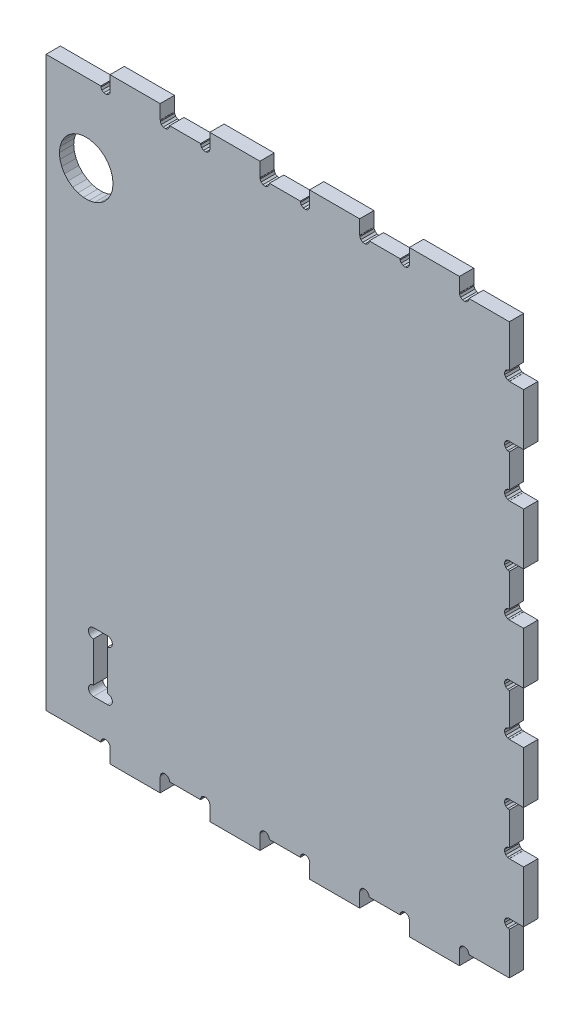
SolidWorks part; units mm, degrees
ref_plane "Спереди" through (0, 0, 0) normal (0, 0, 1) x (1, 0, 0)
ref_plane "Сверху" through (0, 0, 0) normal (0, 1, 0) x (1, 0, 0)
ref_plane "Справа" through (0, 0, 0) normal (1, 0, 0) x (0, 0, -1)
sketch "Sketch1" plane through (0, 0, 0) normal (0, 0, 1) x (1, 0, 0)
  line L0 (-104.444, -500.0143) -> (-104.328, -500.0143)
  line L1 (-104.328, -500.0143) -> (-104.328, -499.0573)
  line L2 (-104.328, -499.0573) -> (-103.438, -497.3623)
  line L3 (-103.438, -497.3623) -> (-101.863, -496.2743)
  line L4 (-101.863, -496.2743) -> (-99.9623, -496.0433)
  line L5 (-99.9623, -496.0433) -> (-98.1722, -496.7223)
  line L6 (-98.1722, -496.7223) -> (-96.9026, -498.1553)
  line L7 (-96.9026, -498.1553) -> (-96.4444, -500.0143)
  line L8 (-96.4444, -500.0143) -> (-70.5504, -500.0143)
  line L9 (-70.5504, -500.0143) -> (-70.5504, -499.0573)
  line L10 (-70.5504, -499.0573) -> (-69.6607, -497.3623)
  line L11 (-69.6607, -497.3623) -> (-68.0851, -496.2743)
  line L12 (-68.0851, -496.2743) -> (-66.1845, -496.0433)
  line L13 (-66.1845, -496.0433) -> (-64.3944, -496.7223)
  line L14 (-64.3944, -496.7223) -> (-63.1248, -498.1553)
  line L15 (-63.1248, -498.1553) -> (-62.6667, -500.0143)
  line L16 (-62.6667, -500.0143) -> (-62.8667, -500.8253)
  line L17 (-62.8667, -500.8253) -> (-62.8667, -512.0143)
  line L18 (-62.8667, -512.0143) -> (-20.8889, -512.0143)
  line L19 (-20.8889, -512.0143) -> (-20.8889, -500.0143)
  line L20 (-20.8889, -500.0143) -> (-20.7726, -500.0143)
  line L21 (-20.7726, -500.0143) -> (-20.7726, -499.0573)
  line L22 (-20.7726, -499.0573) -> (-19.8829, -497.3623)
  line L23 (-19.8829, -497.3623) -> (-18.3073, -496.2743)
  line L24 (-18.3073, -496.2743) -> (-16.4067, -496.0433)
  line L25 (-16.4067, -496.0433) -> (-14.6166, -496.7223)
  line L26 (-14.6166, -496.7223) -> (-13.3471, -498.1553)
  line L27 (-13.3471, -498.1553) -> (-12.8889, -500.0143)
  line L28 (-12.8889, -500.0143) -> (13.0051, -500.0143)
  line L29 (13.0051, -500.0143) -> (13.0051, -499.0573)
  line L30 (13.0051, -499.0573) -> (13.8948, -497.3623)
  line L31 (13.8948, -497.3623) -> (15.4705, -496.2743)
  line L32 (15.4705, -496.2743) -> (17.371, -496.0433)
  line L33 (17.371, -496.0433) -> (19.1611, -496.7223)
  line L34 (19.1611, -496.7223) -> (20.4307, -498.1553)
  line L35 (20.4307, -498.1553) -> (20.8889, -500.0143)
  line L36 (20.8889, -500.0143) -> (20.6889, -500.8253)
  line L37 (20.6889, -500.8253) -> (20.6889, -512.0143)
  line L38 (20.6889, -512.0143) -> (62.6667, -512.0143)
  line L39 (62.6667, -512.0143) -> (62.6667, -500.0143)
  line L40 (62.6667, -500.0143) -> (62.7829, -500.0143)
  line L41 (62.7829, -500.0143) -> (62.7829, -499.0573)
  line L42 (62.7829, -499.0573) -> (63.6726, -497.3623)
  line L43 (63.6726, -497.3623) -> (65.2482, -496.2743)
  line L44 (65.2482, -496.2743) -> (67.1488, -496.0433)
  line L45 (67.1488, -496.0433) -> (68.9389, -496.7223)
  line L46 (68.9389, -496.7223) -> (70.2085, -498.1553)
  line L47 (70.2085, -498.1553) -> (70.6667, -500.0143)
  line L48 (70.6667, -500.0143) -> (96.5607, -500.0143)
  line L49 (96.5607, -500.0143) -> (96.5607, -499.0573)
  line L50 (96.5607, -499.0573) -> (97.4504, -497.3623)
  line L51 (97.4504, -497.3623) -> (99.026, -496.2743)
  line L52 (99.026, -496.2743) -> (100.927, -496.0433)
  line L53 (100.927, -496.0433) -> (102.717, -496.7223)
  line L54 (102.717, -496.7223) -> (103.986, -498.1553)
  line L55 (103.986, -498.1553) -> (104.444, -500.0143)
  line L56 (104.444, -500.0143) -> (104.244, -500.8253)
  line L57 (104.244, -500.8253) -> (104.244, -512.0143)
  line L58 (104.244, -512.0143) -> (146.222, -512.0143)
  line L59 (146.222, -512.0143) -> (146.222, -500.0143)
  line L60 (146.222, -500.0143) -> (146.338, -500.0143)
  line L61 (146.338, -500.0143) -> (146.338, -499.0573)
  line L62 (146.338, -499.0573) -> (147.228, -497.3623)
  line L63 (147.228, -497.3623) -> (148.804, -496.2743)
  line L64 (148.804, -496.2743) -> (150.704, -496.0433)
  line L65 (150.704, -496.0433) -> (152.494, -496.7223)
  line L66 (152.494, -496.7223) -> (153.764, -498.1553)
  line L67 (153.764, -498.1553) -> (154.222, -500.0143)
  line L68 (154.222, -500.0143) -> (188, -500.0143)
  line L69 (188, -500.0143) -> (188, -464.6543)
  line L70 (188, -464.6543) -> (186.582, -464.4813)
  line L71 (186.582, -464.4813) -> (185.006, -463.3943)
  line L72 (185.006, -463.3943) -> (184.116, -461.6993)
  line L73 (184.116, -461.6993) -> (184.116, -459.7843)
  line L74 (184.116, -459.7843) -> (185.006, -458.0893)
  line L75 (185.006, -458.0893) -> (186.582, -457.0013)
  line L76 (186.582, -457.0013) -> (188.482, -456.7703)
  line L77 (188.482, -456.7703) -> (188.933, -456.9413)
  line L78 (188.933, -456.9413) -> (200, -456.9413)
  line L79 (200, -456.9413) -> (200, -413.4693)
  line L80 (200, -413.4693) -> (188, -413.4693)
  line L81 (188, -413.4693) -> (188, -413.3813)
  line L82 (188, -413.3813) -> (186.582, -413.2093)
  line L83 (186.582, -413.2093) -> (185.006, -412.1213)
  line L84 (185.006, -412.1213) -> (184.116, -410.4263)
  line L85 (184.116, -410.4263) -> (184.116, -408.5113)
  line L86 (184.116, -408.5113) -> (185.006, -406.8163)
  line L87 (185.006, -406.8163) -> (186.582, -405.7283)
  line L88 (186.582, -405.7283) -> (188, -405.5563)
  line L89 (188, -405.5563) -> (188, -378.1083)
  line L90 (188, -378.1083) -> (186.582, -377.9363)
  line L91 (186.582, -377.9363) -> (185.006, -376.8483)
  line L92 (185.006, -376.8483) -> (184.116, -375.1533)
  line L93 (184.116, -375.1533) -> (184.116, -373.2393)
  line L94 (184.116, -373.2393) -> (185.006, -371.5433)
  line L95 (185.006, -371.5433) -> (186.582, -370.4563)
  line L96 (186.582, -370.4563) -> (188.482, -370.2253)
  line L97 (188.482, -370.2253) -> (188.933, -370.3963)
  line L98 (188.933, -370.3963) -> (200, -370.3963)
  line L99 (200, -370.3963) -> (200, -326.9233)
  line L100 (200, -326.9233) -> (188, -326.9233)
  line L101 (188, -326.9233) -> (188, -326.8353)
  line L102 (188, -326.8353) -> (186.582, -326.6633)
  line L103 (186.582, -326.6633) -> (185.006, -325.5763)
  line L104 (185.006, -325.5763) -> (184.116, -323.8803)
  line L105 (184.116, -323.8803) -> (184.116, -321.9663)
  line L106 (184.116, -321.9663) -> (185.006, -320.2713)
  line L107 (185.006, -320.2713) -> (186.582, -319.1833)
  line L108 (186.582, -319.1833) -> (188, -319.0113)
  line L109 (188, -319.0113) -> (188, -291.5633)
  line L110 (188, -291.5633) -> (186.582, -291.3903)
  line L111 (186.582, -291.3903) -> (185.006, -290.3033)
  line L112 (185.006, -290.3033) -> (184.116, -288.6083)
  line L113 (184.116, -288.6083) -> (184.116, -286.6933)
  line L114 (184.116, -286.6933) -> (185.006, -284.9983)
  line L115 (185.006, -284.9983) -> (186.582, -283.9103)
  line L116 (186.582, -283.9103) -> (188.482, -283.6803)
  line L117 (188.482, -283.6803) -> (188.933, -283.8503)
  line L118 (188.933, -283.8503) -> (200, -283.8503)
  line L119 (200, -283.8503) -> (200, -240.3783)
  line L120 (200, -240.3783) -> (188, -240.3783)
  line L121 (188, -240.3783) -> (188, -240.2903)
  line L122 (188, -240.2903) -> (186.582, -240.1183)
  line L123 (186.582, -240.1183) -> (185.006, -239.0303)
  line L124 (185.006, -239.0303) -> (184.116, -237.3353)
  line L125 (184.116, -237.3353) -> (184.116, -235.4203)
  line L126 (184.116, -235.4203) -> (185.006, -233.7253)
  line L127 (185.006, -233.7253) -> (186.582, -232.6383)
  line L128 (186.582, -232.6383) -> (188, -232.4653)
  line L129 (188, -232.4653) -> (188, -205.0173)
  line L130 (188, -205.0173) -> (186.582, -204.8453)
  line L131 (186.582, -204.8453) -> (185.006, -203.7573)
  line L132 (185.006, -203.7573) -> (184.116, -202.0623)
  line L133 (184.116, -202.0623) -> (184.116, -200.1483)
  line L134 (184.116, -200.1483) -> (185.006, -198.4523)
  line L135 (185.006, -198.4523) -> (186.582, -197.3653)
  line L136 (186.582, -197.3653) -> (188.482, -197.1343)
  line L137 (188.482, -197.1343) -> (188.933, -197.3053)
  line L138 (188.933, -197.3053) -> (200, -197.3053)
  line L139 (200, -197.3053) -> (200, -153.8323)
  line L140 (200, -153.8323) -> (188, -153.8323)
  line L141 (188, -153.8323) -> (188, -153.7443)
  line L142 (188, -153.7443) -> (186.582, -153.5723)
  line L143 (186.582, -153.5723) -> (185.006, -152.4853)
  line L144 (185.006, -152.4853) -> (184.116, -150.7893)
  line L145 (184.116, -150.7893) -> (184.116, -148.8753)
  line L146 (184.116, -148.8753) -> (185.006, -147.1803)
  line L147 (185.006, -147.1803) -> (186.582, -146.0923)
  line L148 (186.582, -146.0923) -> (188, -145.9203)
  line L149 (188, -145.9203) -> (188, -118.4723)
  line L150 (188, -118.4723) -> (186.582, -118.3003)
  line L151 (186.582, -118.3003) -> (185.006, -117.2123)
  line L152 (185.006, -117.2123) -> (184.116, -115.5173)
  line L153 (184.116, -115.5173) -> (184.116, -113.6023)
  line L154 (184.116, -113.6023) -> (185.006, -111.9073)
  line L155 (185.006, -111.9073) -> (186.582, -110.8193)
  line L156 (186.582, -110.8193) -> (188.482, -110.5893)
  line L157 (188.482, -110.5893) -> (188.933, -110.7593)
  line L158 (188.933, -110.7593) -> (200, -110.7593)
  line L159 (200, -110.7593) -> (200, -67.287)
  line L160 (200, -67.287) -> (188, -67.287)
  line L161 (188, -67.287) -> (188, -67.1993)
  line L162 (188, -67.1993) -> (186.582, -67.0271)
  line L163 (186.582, -67.0271) -> (185.006, -65.9395)
  line L164 (185.006, -65.9395) -> (184.116, -64.2443)
  line L165 (184.116, -64.2443) -> (184.116, -62.3298)
  line L166 (184.116, -62.3298) -> (185.006, -60.6345)
  line L167 (185.006, -60.6345) -> (186.582, -59.547)
  line L168 (186.582, -59.547) -> (188, -59.3747)
  line L169 (188, -59.3747) -> (188, -24.0143)
  line L170 (188, -24.0143) -> (154.222, -24.0143)
  line L171 (154.222, -24.0143) -> (153.764, -25.8732)
  line L172 (153.764, -25.8732) -> (152.494, -27.3062)
  line L173 (152.494, -27.3062) -> (150.704, -27.9851)
  line L174 (150.704, -27.9851) -> (148.804, -27.7544)
  line L175 (148.804, -27.7544) -> (147.228, -26.6668)
  line L176 (147.228, -26.6668) -> (146.338, -24.9716)
  line L177 (146.338, -24.9716) -> (146.338, -24.0143)
  line L178 (146.338, -24.0143) -> (146.222, -24.0143)
  line L179 (146.222, -24.0143) -> (146.222, -12.0143)
  line L180 (146.222, -12.0143) -> (104.244, -12.0143)
  line L181 (104.244, -12.0143) -> (104.244, -23.2028)
  line L182 (104.244, -23.2028) -> (104.444, -24.0143)
  line L183 (104.444, -24.0143) -> (103.986, -25.8732)
  line L184 (103.986, -25.8732) -> (102.717, -27.3062)
  line L185 (102.717, -27.3062) -> (100.927, -27.9851)
  line L186 (100.927, -27.9851) -> (99.026, -27.7544)
  line L187 (99.026, -27.7544) -> (97.4504, -26.6668)
  line L188 (97.4504, -26.6668) -> (96.5607, -24.9716)
  line L189 (96.5607, -24.9716) -> (96.5607, -24.0143)
  line L190 (96.5607, -24.0143) -> (70.6667, -24.0143)
  line L191 (70.6667, -24.0143) -> (70.2085, -25.8732)
  line L192 (70.2085, -25.8732) -> (68.9389, -27.3062)
  line L193 (68.9389, -27.3062) -> (67.1488, -27.9851)
  line L194 (67.1488, -27.9851) -> (65.2482, -27.7544)
  line L195 (65.2482, -27.7544) -> (63.6726, -26.6668)
  line L196 (63.6726, -26.6668) -> (62.7829, -24.9716)
  line L197 (62.7829, -24.9716) -> (62.7829, -24.0143)
  line L198 (62.7829, -24.0143) -> (62.6667, -24.0143)
  line L199 (62.6667, -24.0143) -> (62.6667, -12.0143)
  line L200 (62.6667, -12.0143) -> (20.6889, -12.0143)
  line L201 (20.6889, -12.0143) -> (20.6889, -23.2029)
  line L202 (20.6889, -23.2029) -> (20.8889, -24.0143)
  line L203 (20.8889, -24.0143) -> (20.4307, -25.8732)
  line L204 (20.4307, -25.8732) -> (19.1611, -27.3062)
  line L205 (19.1611, -27.3062) -> (17.371, -27.9851)
  line L206 (17.371, -27.9851) -> (15.4705, -27.7544)
  line L207 (15.4705, -27.7544) -> (13.8948, -26.6668)
  line L208 (13.8948, -26.6668) -> (13.0051, -24.9716)
  line L209 (13.0051, -24.9716) -> (13.0051, -24.0143)
  line L210 (13.0051, -24.0143) -> (-12.8889, -24.0143)
  line L211 (-12.8889, -24.0143) -> (-13.3471, -25.8732)
  line L212 (-13.3471, -25.8732) -> (-14.6166, -27.3062)
  line L213 (-14.6166, -27.3062) -> (-16.4067, -27.9851)
  line L214 (-16.4067, -27.9851) -> (-18.3073, -27.7544)
  line L215 (-18.3073, -27.7544) -> (-19.8829, -26.6668)
  line L216 (-19.8829, -26.6668) -> (-20.7726, -24.9716)
  line L217 (-20.7726, -24.9716) -> (-20.7726, -24.0143)
  line L218 (-20.7726, -24.0143) -> (-20.8889, -24.0143)
  line L219 (-20.8889, -24.0143) -> (-20.8889, -12.0143)
  line L220 (-20.8889, -12.0143) -> (-62.8667, -12.0143)
  line L221 (-62.8667, -12.0143) -> (-62.8667, -23.2029)
  line L222 (-62.8667, -23.2029) -> (-62.6667, -24.0143)
  line L223 (-62.6667, -24.0143) -> (-63.1248, -25.8732)
  line L224 (-63.1248, -25.8732) -> (-64.3944, -27.3062)
  line L225 (-64.3944, -27.3062) -> (-66.1845, -27.9851)
  line L226 (-66.1845, -27.9851) -> (-68.0851, -27.7544)
  line L227 (-68.0851, -27.7544) -> (-69.6607, -26.6668)
  line L228 (-69.6607, -26.6668) -> (-70.5504, -24.9716)
  line L229 (-70.5504, -24.9716) -> (-70.5504, -24.0143)
  line L230 (-70.5504, -24.0143) -> (-96.4444, -24.0143)
  line L231 (-96.4444, -24.0143) -> (-96.9026, -25.8732)
  line L232 (-96.9026, -25.8732) -> (-98.1722, -27.3062)
  line L233 (-98.1722, -27.3062) -> (-99.9623, -27.9851)
  line L234 (-99.9623, -27.9851) -> (-101.863, -27.7544)
  line L235 (-101.863, -27.7544) -> (-103.438, -26.6668)
  line L236 (-103.438, -26.6668) -> (-104.328, -24.9716)
  line L237 (-104.328, -24.9716) -> (-104.328, -24.0143)
  line L238 (-104.328, -24.0143) -> (-104.444, -24.0143)
  line L239 (-104.444, -24.0143) -> (-104.444, -12.0143)
  line L240 (-104.444, -12.0143) -> (-146.422, -12.0143)
  line L241 (-146.422, -12.0143) -> (-146.422, -23.2029)
  line L242 (-146.422, -23.2029) -> (-146.222, -24.0143)
  line L243 (-146.222, -24.0143) -> (-146.68, -25.8732)
  line L244 (-146.68, -25.8732) -> (-147.95, -27.3062)
  line L245 (-147.95, -27.3062) -> (-149.74, -27.9851)
  line L246 (-149.74, -27.9851) -> (-151.641, -27.7544)
  line L247 (-151.641, -27.7544) -> (-153.216, -26.6668)
  line L248 (-153.216, -26.6668) -> (-154.106, -24.9716)
  line L249 (-154.106, -24.9716) -> (-154.106, -24.0143)
  line L250 (-154.106, -24.0143) -> (-200, -24.0143)
  line L251 (-200, -24.0143) -> (-200, -500.0143)
  line L252 (-200, -500.0143) -> (-154.106, -500.0143)
  line L253 (-154.106, -500.0143) -> (-154.106, -499.0573)
  line L254 (-154.106, -499.0573) -> (-153.216, -497.3623)
  line L255 (-153.216, -497.3623) -> (-151.641, -496.2743)
  line L256 (-151.641, -496.2743) -> (-149.74, -496.0433)
  line L257 (-149.74, -496.0433) -> (-147.95, -496.7223)
  line L258 (-147.95, -496.7223) -> (-146.68, -498.1553)
  line L259 (-146.68, -498.1553) -> (-146.222, -500.0143)
  line L260 (-146.222, -500.0143) -> (-146.422, -500.8253)
  line L261 (-146.422, -500.8253) -> (-146.422, -512.0143)
  line L262 (-146.422, -512.0143) -> (-104.444, -512.0143)
  line L263 (-104.444, -512.0143) -> (-104.444, -500.0143)
  line L264 (-168.711, -112.1412) -> (-173.302, -111.1662)
  line L265 (-173.302, -111.1662) -> (-177.59, -109.2562)
  line L266 (-177.59, -109.2562) -> (-181.388, -106.4972)
  line L267 (-181.388, -106.4972) -> (-184.528, -103.0092)
  line L268 (-184.528, -103.0092) -> (-186.875, -98.9442)
  line L269 (-186.875, -98.9442) -> (-188.326, -94.48)
  line L270 (-188.326, -94.48) -> (-188.817, -89.8118)
  line L271 (-188.817, -89.8118) -> (-188.326, -85.1436)
  line L272 (-188.326, -85.1436) -> (-186.875, -80.6794)
  line L273 (-186.875, -80.6794) -> (-184.528, -76.6143)
  line L274 (-184.528, -76.6143) -> (-181.388, -73.1261)
  line L275 (-181.388, -73.1261) -> (-177.59, -70.367)
  line L276 (-177.59, -70.367) -> (-173.302, -68.4578)
  line L277 (-173.302, -68.4578) -> (-168.711, -67.4819)
  line L278 (-168.711, -67.4819) -> (-164.017, -67.4819)
  line L279 (-164.017, -67.4819) -> (-159.425, -68.4578)
  line L280 (-159.425, -68.4578) -> (-155.137, -70.367)
  line L281 (-155.137, -70.367) -> (-151.34, -73.1261)
  line L282 (-151.34, -73.1261) -> (-148.199, -76.6143)
  line L283 (-148.199, -76.6143) -> (-145.852, -80.6794)
  line L284 (-145.852, -80.6794) -> (-144.401, -85.1436)
  line L285 (-144.401, -85.1436) -> (-143.911, -89.8118)
  line L286 (-143.911, -89.8118) -> (-144.401, -94.48)
  line L287 (-144.401, -94.48) -> (-145.852, -98.9442)
  line L288 (-145.852, -98.9442) -> (-148.199, -103.0092)
  line L289 (-148.199, -103.0092) -> (-151.34, -106.4972)
  line L290 (-151.34, -106.4972) -> (-155.137, -109.2562)
  line L291 (-155.137, -109.2562) -> (-159.425, -111.1662)
  line L292 (-159.425, -111.1662) -> (-164.017, -112.1412)
  line L293 (-164.017, -112.1412) -> (-168.711, -112.1412)
  line L294 (-164.017, -67.4819) -> (-168.711, -112.1412) construction
  line L295 (-148.564, -470.0143) -> (-160.364, -470.0143)
  line L296 (-148.564, -461.8143) -> (-148.564, -428.2143)
  line L297 (-148.564, -420.0143) -> (-160.364, -420.0143)
  line L298 (-160.364, -461.8143) -> (-160.364, -428.2143)
  line L300 (-166.364, -89.8115) -> (-166.364, -500.0143) construction
  arc A0 (-148.564, -420.0143) -> (-148.564, -428.2143) centre (-148.564, -424.1143) cw
  arc A1 (-148.564, -470.0143) -> (-148.564, -461.8143) centre (-148.564, -465.9143) ccw
  arc A2 (-160.364, -470.0143) -> (-160.364, -461.8143) centre (-160.364, -465.9143) cw
  arc A3 (-160.364, -420.0143) -> (-160.364, -428.2143) centre (-160.364, -424.1143) ccw
  dimension "D5" = 4.1
  dimension "D1" = 11.8
  dimension "D2" = 6
  dimension "D3" = 30
  dimension "D4" = 50
  dimension "D6" = 39.636
extrude "Boss-Extrude1" add sketch "Sketch1" along normal blind 12
sketch "Sketch2" plane through (0, 0, 0) normal (0, 0, -1) x (-1, 0, 0)
  circle A0 centre (166.364, -89.8104) radius 22.453
